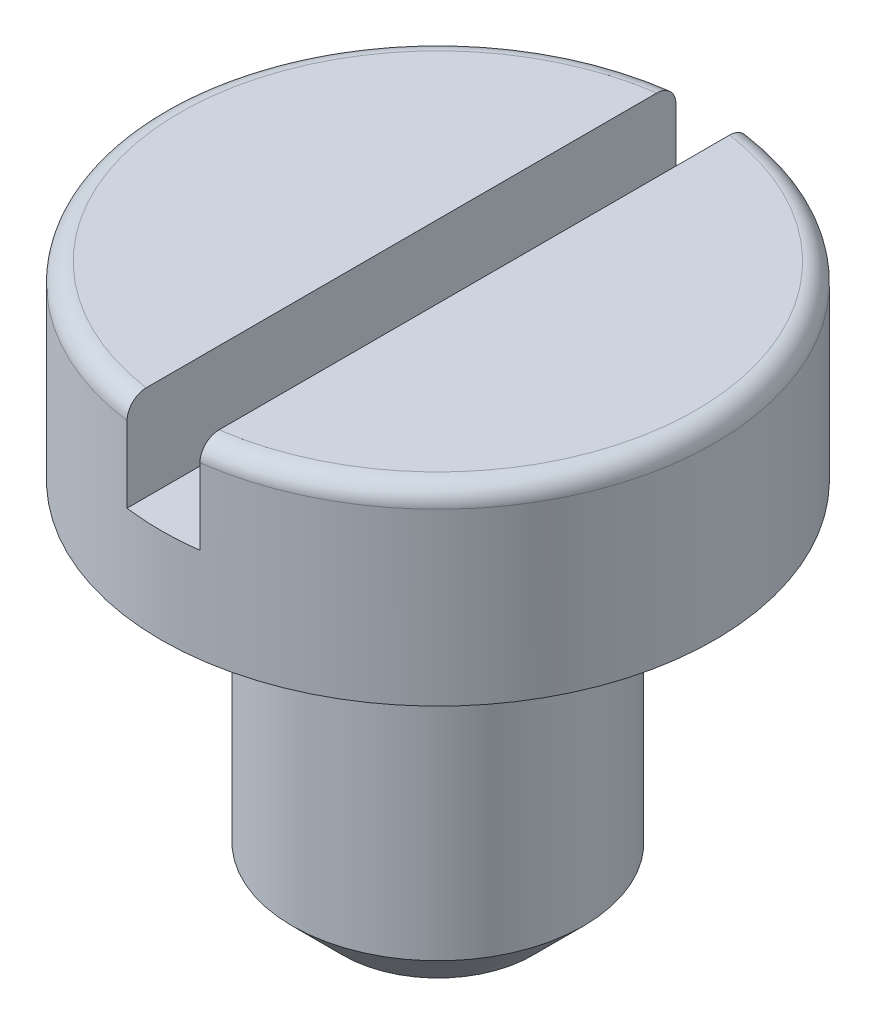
SolidWorks part; units mm, degrees
ref_plane "Face" through (0, 0, 0) normal (0, 0, 1) x (1, 0, 0)
ref_plane "Dessus" through (0, 0, 0) normal (0, 1, 0) x (1, 0, 0)
ref_plane "Droite" through (0, 0, 0) normal (1, 0, 0) x (0, 0, -1)
sketch "Esquisse1" plane through (0, 0, 0) normal (0, 1, 0) x (1, 0, 0)
  circle A0 centre (0, 0) radius 1
  dimension "Diamètre nominal" = 2
extrude "Base-Extrusion" add sketch "Esquisse1" against normal blind 2.5
chamfer "Chanfrein1" distance 0.35 angle 45 1 edges at (0, -2.5, 1)
sketch "Esquisse2" plane through (0, 0, 0) normal (0, 0, 1) x (1, 0, 0)
  line L0 (0, 1.3) -> (0, 0)
  line L2 (0, 0) -> (1.9, 0)
  line L4 (0, 1.3) -> (1.77, 1.3)
  line L5 (1.9, 0) -> (1.9, 1.17)
  line L7 (0, 1.3) -> (0, -2.5) construction
  line L8 (0, -2.15) -> (0, 0) construction
  line L9 (-0.65, -2.5) -> (0.65, -2.5) construction
  arc A0 (1.9, 1.17) -> (1.77, 1.3) centre (1.77, 1.17) ccw
  dimension "D2" = 0.13
  dimension "D1" = 3.8
  dimension "Hauteur tête" = 1.3
revolve "Boss.-Révol.1" add sketch "Esquisse2" angle 360 about L7
sketch "Esquisse3" plane through (0, 1.3, 0) normal (0, 1, 0) x (-1, 0, 0)
  line L0 (0, -1.9) -> (0, 1.9) construction
  line L1 (0.25, -1.9) -> (-0.25, -1.9)
  line L2 (0.25, 1.9) -> (-0.25, 1.9)
  line L3 (0.25, -1.9) -> (0.25, 1.9)
  line L4 (-0.25, -1.9) -> (-0.25, 1.9)
  circle A0 centre (0, 0) radius 1.9 construction
  dimension "Largeur fente" = 0.5
extrude "Enlèv. mat.-Extru.1" cut sketch "Esquisse3" against normal blind 0.65
